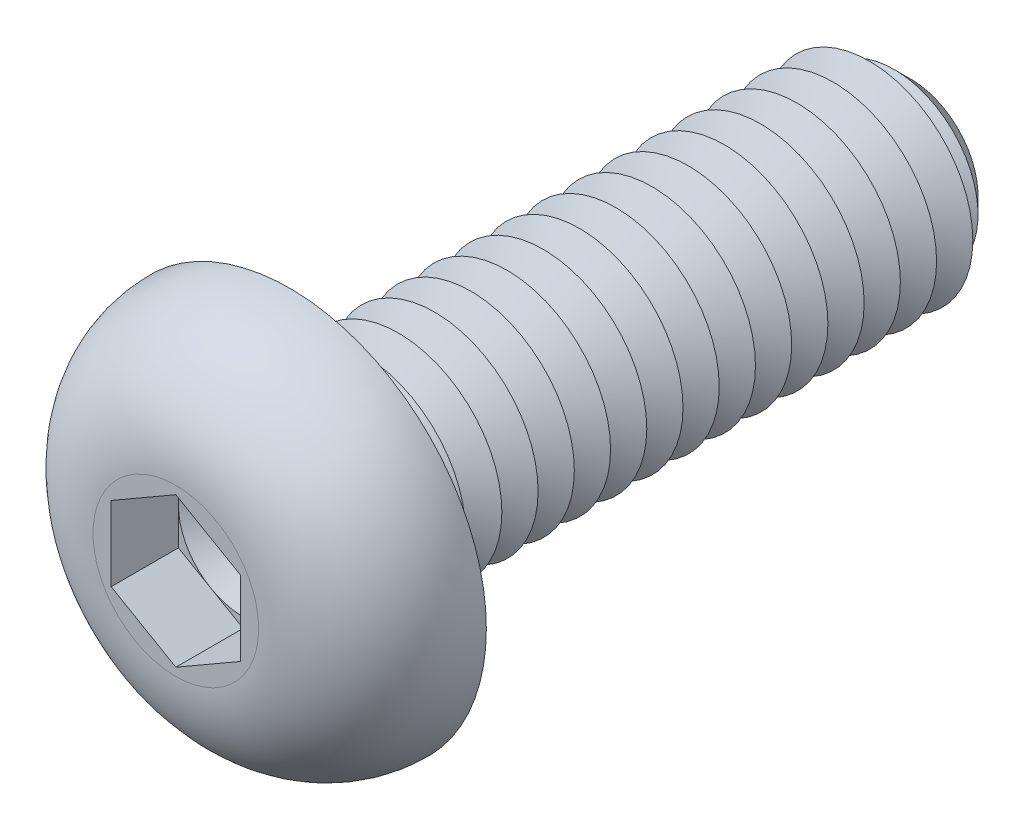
SolidWorks part; units mm, degrees
ref_plane "Front Plane" through (0, 0, 0) normal (0, 0, 1) x (1, 0, 0)
ref_plane "Top Plane" through (0, 0, 0) normal (0, 1, 0) x (1, 0, 0)
ref_plane "Right Plane" through (0, 0, 0) normal (1, 0, 0) x (0, 0, -1)
sketch "Sketch1" plane through (0, 0, 0) normal (1, 0, 0) x (0, 0, -1)
  line L0 (-47.9342, 0) -> (60.3146, 0) construction
sketch "Sketch2" plane through (0, 0, 0) normal (1, 0, 0) x (0, 0, -1)
  line L0 (0, 0) -> (-2.2, 0)
  line L1 (-47.9342, 0) -> (60.3146, 0) construction
  line L2 (-2.2, 0) -> (-2.2, 1.6)
  line L3 (0, 3.8) -> (0, 0)
  arc A0 (-2.2, 1.6) -> (0, 3.8) centre (0, 1.6) cw
  dimension "D1" = 2.2
  dimension "D2" = 2.2
  dimension "D3" = 3.8
revolve "Revolve1" add sketch "Sketch2" angle 360 about L0
sketch "Sketch3" plane through (0, 0, 2.2) normal (0, 0, 1) x (1, 0, 0)
  line L1 (0, 1.4434) -> (-1.25, 0.7217)
  line L2 (-1.25, 0.7217) -> (-1.25, -0.7217)
  line L3 (-1.25, -0.7217) -> (0, -1.4434)
  line L4 (0, -1.4434) -> (1.25, -0.7217)
  line L5 (1.25, -0.7217) -> (1.25, 0.7217)
  line L6 (1.25, 0.7217) -> (0, 1.4434)
  circle A0 centre (0, 0) radius 1.25 construction
  dimension "D1" = 2.5
extrude "Cut-Extrude1" cut sketch "Sketch3" against normal blind 1.3
sketch "Sketch4" plane through (0, 0, 0) normal (0, 0, -1) x (-1, 0, 0)
  circle A0 centre (0, 0) radius 2
  dimension "D1" = 4
extrude "Boss-Extrude1" add sketch "Sketch4" along normal blind 12
chamfer "Chamfer1" distance 0.7 angle 45 1 edges at (-2, 0, -12)
sketch "Sketch5" plane through (0, 0, 0) normal (1, 0, 0) x (0, 0, -1)
  line L0 (0.7, 2) -> (1.4, 2)
  line L1 (11.3, 2) -> (0, 2) construction
  line L2 (1.4, 2) -> (1.05, 1.3938)
  line L3 (1.05, 1.3938) -> (0.7, 2)
  line L4 (0, -3.8) -> (0, 3.8) construction
  line L5 (11.3, 2) -> (0, 2) construction
  dimension "D1" = 0.7
  dimension "D2" = 0.7
revolve "Cut-Revolve1" cut sketch "Sketch5" angle 360 about L0
pattern_linear "LPattern1" count 16 spacing 0.7 along (0, 0, -1) of "Cut-Revolve1"
fillet "Fillet2" radius 0.3 1 edges at (2, 0, 0)
sketch "Sketch6" plane through (0, 0, 0.9) normal (0, 0, 1) x (1, 0, 0)
  line L0 (0, -1.4434) -> (1.25, -0.7217) construction
  circle A0 centre (0, 0) radius 1.25
extrude "Cut-Extrude2" cut sketch "Sketch6" against normal through all draft 60
